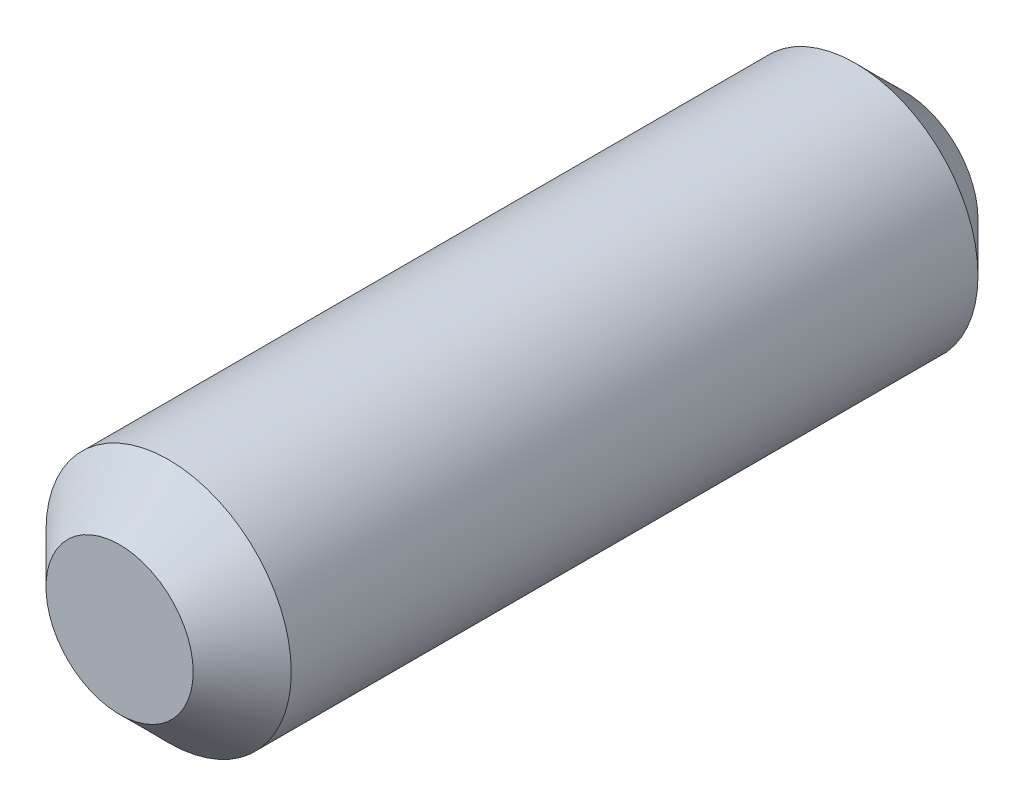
SolidWorks part; units mm, degrees
ref_plane "Front Plane" through (0, 0, 0) normal (0, 0, 1) x (1, 0, 0)
ref_plane "Top Plane" through (0, 0, 0) normal (0, 1, 0) x (1, 0, 0)
ref_plane "Right Plane" through (0, 0, 0) normal (1, 0, 0) x (0, 0, -1)
sketch "Sketch1" plane through (0, 0, 0) normal (0, 0, 1) x (1, 0, 0)
  circle A0 centre (-3.1438, 6.8287) radius 1.25 construction
  circle A1 centre (-3.1438, 6.8287) radius 1.25
extrude "Boss-Extrude1" add sketch "Sketch1" against normal blind 8
chamfer "Chamfer1" distance 0.5 angle 45 2 edges at (-1.8938, 6.8287, -8) (-1.8938, 6.8287, 0)
